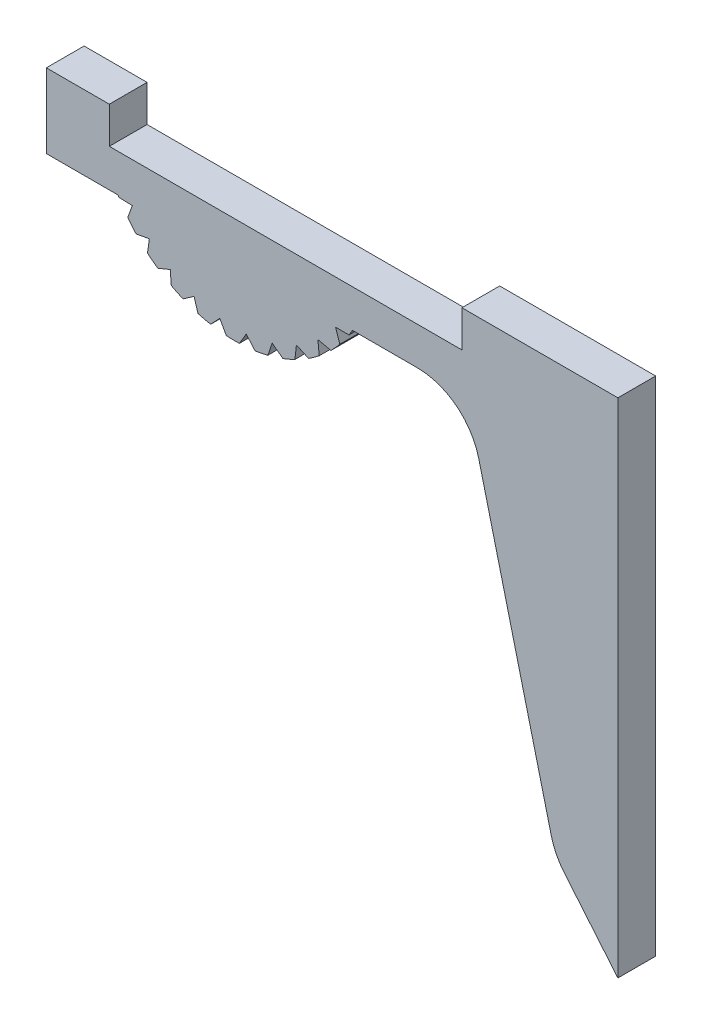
SolidWorks part; units mm, degrees
ref_plane "Plan de face" through (0, 0, 0) normal (0, 0, 1) x (1, 0, 0)
ref_plane "Plan de dessus" through (0, 0, 0) normal (0, 1, 0) x (1, 0, 0)
ref_plane "Plan de droite" through (0, 0, 0) normal (1, 0, 0) x (0, 0, -1)
sketch "Esquisse1" plane through (0, 0, 0) normal (0, 0, 1) x (1, 0, 0)
  line L0 (0, -40) -> (0, 0)
  line L1 (0, 0) -> (-200, 0) construction
  line L2 (0, 0) -> (-45.3847, 0)
  line L3 (-45.3847, 0) -> (-45.3847, -6)
  line L4 (-45.3847, -6) -> (-12, -6)
  line L5 (-12, -6) -> (-5, -34)
  line L6 (-5, -34) -> (0, -40)
  dimension "D1" = 6
  dimension "D2" = 5
  dimension "D3" = 6
  dimension "D4" = 40
  dimension "D5" = 12
extrude "Boss.-Extru.1" add sketch "Esquisse1" against normal blind 3
sketch "Esquisse2" plane through (0, 0, -3) normal (0, 0, -1) x (-1, 0, 0)
  line L1 (12.3847, 0) -> (40.3847, 0)
  line L2 (12.3847, 0) -> (12.3847, -3)
  line L3 (12.3847, -3) -> (40.3847, -3)
  line L4 (40.3847, 0) -> (40.3847, -3)
extrude "Enlèv. mat.-Extru.1" cut sketch "Esquisse2" against normal blind 3
sketch "Esquisse3" plane through (0, 0, 0) normal (0, 0, 1) x (1, 0, 0)
  line L0 (0, -40) -> (0, 0) construction
  line L1 (-45.3847, 0) -> (0, 0)
  line L2 (-45.3847, 0) -> (-45.3847, -0.1)
  line L3 (-45.3847, -0.1) -> (0, -0.1)
  line L4 (0, 0) -> (0, -0.1)
  dimension "D1" = 0.1
extrude "Enlèv. mat.-Extru.2" cut sketch "Esquisse3" against normal blind 10
fillet "Congé1" radius 5 1 edges at (-12, -6, -1.5)
fillet "Congé2" radius 5 1 edges at (-5, -34, -1.5)
sketch "Esquisse4" plane through (0, 0, -3) normal (0, 0, -1) x (-1, 0, 0)
  line L0 (21.0742, -6) -> (39.6951, -6)
  line L29 (38.9217, -7.1647) -> (38.5578, -6.1648)
  line L30 (38.5578, -6.1648) -> (39.6212, -6.1268)
  line L31 (39.6951, -6) -> (45.3847, -6)
  line L32 (45.3847, -6) -> (45.3847, 21)
  line L33 (45.3847, 21) -> (0, 21)
  line L34 (0, 21) -> (0, 35)
  line L35 (0, 35) -> (-7.0303, 25.296)
  line L36 (-7.9813, 22.3625) -> (-7.9813, 5)
  line L37 (-2.9813, 0) -> (1, 0)
  line L38 (1, 0) -> (1, -1)
  line L39 (6, -6) -> (21.0742, -6)
  line L40 (21.3496, -6.4535) -> (22.4136, -6.4535)
  line L41 (22.4136, -6.4535) -> (22.0856, -7.4657)
  line L42 (22.7815, -8.2348) -> (23.8214, -8.0096)
  line L43 (23.8214, -8.0096) -> (23.7152, -9.0683)
  line L44 (24.5581, -9.6727) -> (25.5267, -9.2324)
  line L45 (25.5267, -9.2324) -> (25.647, -10.2896)
  line L46 (26.5988, -10.7019) -> (27.4523, -10.0665)
  line L47 (27.4523, -10.0665) -> (27.7937, -11.0742)
  line L48 (28.8112, -11.2757) -> (29.5108, -10.474)
  line L49 (29.5108, -10.474) -> (30.0578, -11.3866)
  line L50 (31.0948, -11.3681) -> (31.6089, -10.4365)
  line L51 (31.6089, -10.4365) -> (32.3367, -11.2126)
  line L52 (33.3463, -10.975) -> (33.6515, -9.9557)
  line L53 (33.6515, -9.9557) -> (34.5271, -10.5601)
  line L54 (35.4635, -10.1141) -> (35.546, -9.0533)
  line L55 (35.546, -9.0533) -> (36.5298, -9.4587)
  line L56 (37.3505, -8.8245) -> (37.2065, -7.7703)
  line L57 (37.2065, -7.7703) -> (38.2538, -7.9582)
  line L58 (38.9217, -7.1647) -> (38.5578, -6.1648)
  line L59 (38.5578, -6.1648) -> (39.6212, -6.1268)
  line L69 (21.3496, -6.4535) -> (22.4136, -6.4535)
  line L70 (22.4136, -6.4535) -> (22.0856, -7.4657)
  line L71 (22.7815, -8.2348) -> (23.8214, -8.0096)
  line L72 (23.8214, -8.0096) -> (23.7152, -9.0683)
  line L73 (24.5581, -9.6727) -> (25.5267, -9.2324)
  line L74 (25.5267, -9.2324) -> (25.647, -10.2896)
  line L75 (26.5988, -10.7019) -> (27.4523, -10.0665)
  line L76 (27.4523, -10.0665) -> (27.7937, -11.0742)
  line L77 (28.8112, -11.2757) -> (29.5108, -10.474)
  line L78 (29.5108, -10.474) -> (30.0578, -11.3866)
  line L79 (31.0948, -11.3681) -> (31.6089, -10.4365)
  line L80 (31.6089, -10.4365) -> (32.3367, -11.2126)
  line L81 (33.3463, -10.975) -> (33.6515, -9.9557)
  line L82 (33.6515, -9.9557) -> (34.5271, -10.5601)
  line L83 (35.4635, -10.1141) -> (35.546, -9.0533)
  line L84 (35.546, -9.0533) -> (36.5298, -9.4587)
  line L85 (37.3505, -8.8245) -> (37.2065, -7.7703)
  line L86 (37.2065, -7.7703) -> (38.2538, -7.9582)
  arc A14 (39.6212, -6.1268) -> (39.6951, -6) centre (30.3847, -0.657) ccw
  arc A15 (-7.0303, 25.296) -> (-7.9813, 22.3625) centre (-2.9813, 22.3625) ccw
  arc A16 (-7.9813, 5) -> (-2.9813, 0) centre (-2.9813, 5) ccw
  arc A17 (1, -1) -> (6, -6) centre (6, -1) ccw
  arc A18 (21.0742, -6) -> (21.3496, -6.4535) centre (30.3847, -0.657) ccw
  arc A19 (22.0856, -7.4657) -> (22.7815, -8.2348) centre (30.3847, -0.657) ccw
  arc A20 (23.7152, -9.0683) -> (24.5581, -9.6727) centre (30.3847, -0.657) ccw
  arc A21 (25.647, -10.2896) -> (26.5988, -10.7019) centre (30.3847, -0.657) ccw
  arc A22 (27.7937, -11.0742) -> (28.8112, -11.2757) centre (30.3847, -0.657) ccw
  arc A23 (30.0578, -11.3866) -> (31.0948, -11.3681) centre (30.3847, -0.657) ccw
  arc A24 (32.3367, -11.2126) -> (33.3463, -10.975) centre (30.3847, -0.657) ccw
  arc A25 (34.5271, -10.5601) -> (35.4635, -10.1141) centre (30.3847, -0.657) ccw
  arc A26 (36.5298, -9.4587) -> (37.3505, -8.8245) centre (30.3847, -0.657) ccw
  arc A27 (38.2538, -7.9582) -> (38.9217, -7.1647) centre (30.3847, -0.657) ccw
  arc A28 (39.6212, -6.1268) -> (39.6951, -6) centre (30.3847, -0.657) ccw
  arc A32 (21.0742, -6) -> (21.3496, -6.4535) centre (30.3847, -0.657) ccw
  arc A33 (22.0856, -7.4657) -> (22.7815, -8.2348) centre (30.3847, -0.657) ccw
  arc A34 (23.7152, -9.0683) -> (24.5581, -9.6727) centre (30.3847, -0.657) ccw
  arc A35 (25.647, -10.2896) -> (26.5988, -10.7019) centre (30.3847, -0.657) ccw
  arc A36 (27.7937, -11.0742) -> (28.8112, -11.2757) centre (30.3847, -0.657) ccw
  arc A37 (30.0578, -11.3866) -> (31.0948, -11.3681) centre (30.3847, -0.657) ccw
  arc A38 (32.3367, -11.2126) -> (33.3463, -10.975) centre (30.3847, -0.657) ccw
  arc A39 (34.5271, -10.5601) -> (35.4635, -10.1141) centre (30.3847, -0.657) ccw
  arc A40 (36.5298, -9.4587) -> (37.3505, -8.8245) centre (30.3847, -0.657) ccw
  arc A41 (38.2538, -7.9582) -> (38.9217, -7.1647) centre (30.3847, -0.657) ccw
  dimension "D1" = 0
extrude "Boss.-Extru.2" add sketch "Esquisse4" against normal blind 3
